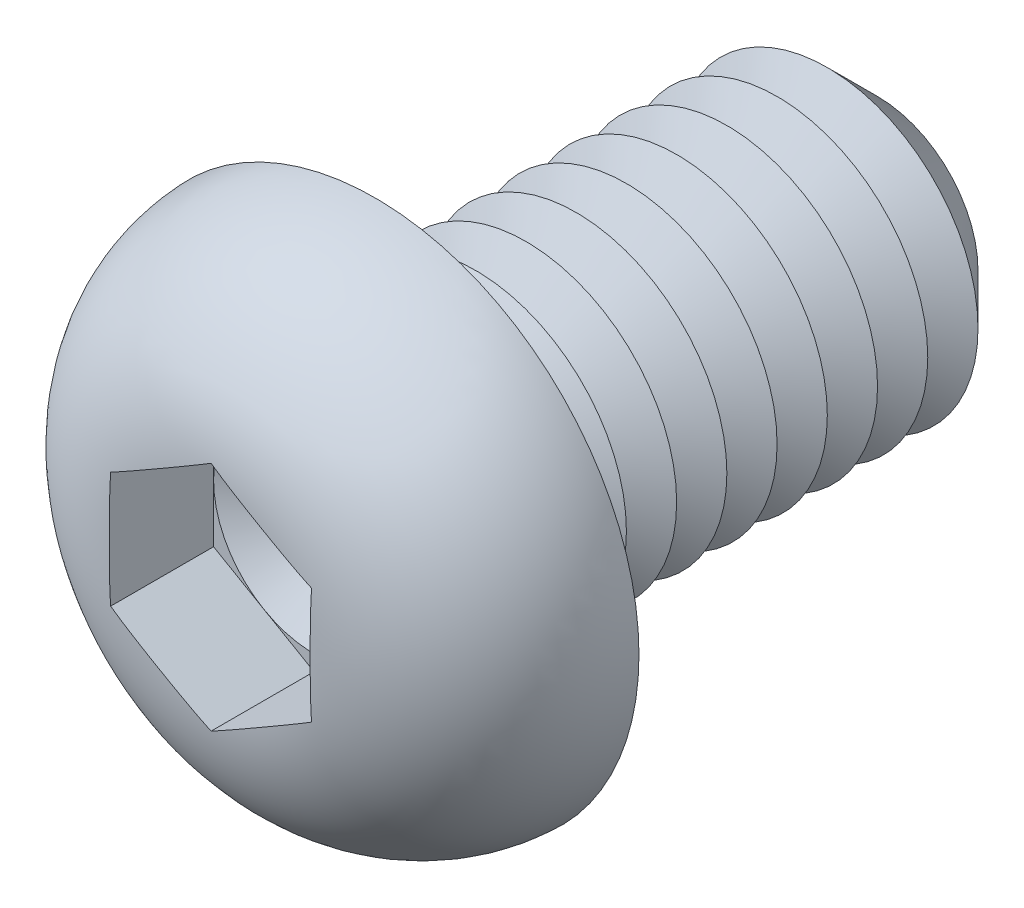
SolidWorks part; units mm, degrees
ref_plane "Front Plane" through (0, 0, 0) normal (0, 0, 1) x (1, 0, 0)
ref_plane "Top Plane" through (0, 0, 0) normal (0, 1, 0) x (1, 0, 0)
ref_plane "Right Plane" through (0, 0, 0) normal (1, 0, 0) x (0, 0, -1)
sketch "Sketch1" plane through (0, 0, 0) normal (1, 0, 0) x (0, 0, -1)
  line L0 (-47.9342, 0) -> (60.3146, 0) construction
sketch "Sketch2" plane through (0, 0, 0) normal (1, 0, 0) x (0, 0, -1)
  line L0 (0, 0) -> (-3.3, 0)
  line L1 (-47.9342, 0) -> (60.3146, 0) construction
  line L2 (-3.3, 0) -> (-3.3, 1.8515)
  line L3 (0, 5.25) -> (0, 0)
  arc A0 (-3.3, 1.8515) -> (0, 5.25) centre (0.1, 1.8515) cw
  dimension "D1" = 3.4
  dimension "D2" = 3.3
  dimension "D3" = 5.25
revolve "Revolve1" add sketch "Sketch2" angle 360 about L0
sketch "Sketch3" plane through (0, 0, 3.3) normal (0, 0, 1) x (1, 0, 0)
  line L1 (0, 2.3094) -> (-2, 1.1547)
  line L2 (-2, 1.1547) -> (-2, -1.1547)
  line L3 (-2, -1.1547) -> (0, -2.3094)
  line L4 (0, -2.3094) -> (2, -1.1547)
  line L5 (2, -1.1547) -> (2, 1.1547)
  line L6 (2, 1.1547) -> (0, 2.3094)
  circle A0 centre (0, 0) radius 2 construction
  dimension "D1" = 4
extrude "Cut-Extrude1" cut sketch "Sketch3" against normal blind 2.08
sketch "Sketch4" plane through (0, 0, 0) normal (0, 0, -1) x (-1, 0, 0)
  circle A0 centre (0, 0) radius 3
  dimension "D1" = 6
extrude "Boss-Extrude1" add sketch "Sketch4" along normal blind 10
chamfer "Chamfer1" distance 1 angle 45 1 edges at (-3, 0, -10)
sketch "Sketch5" plane through (0, 0, 0) normal (1, 0, 0) x (0, 0, -1)
  line L0 (1, 3) -> (2, 3)
  line L1 (9, 3) -> (0, 3) construction
  line L2 (2, 3) -> (1.5, 2.134)
  line L3 (1.5, 2.134) -> (1, 3)
  line L4 (0, -5.25) -> (0, 5.25) construction
  line L5 (9, 3) -> (0, 3) construction
  dimension "D1" = 1
  dimension "D2" = 1
revolve "Cut-Revolve1" cut sketch "Sketch5" angle 360 about L0
pattern_linear "LPattern1" count 8 spacing 1 along (0, 0, -1) of "Cut-Revolve1"
fillet "Fillet2" radius 0.5 1 edges at (-3, 0, 0)
sketch "Sketch6" plane through (0, 0, 1.22) normal (0, 0, 1) x (1, 0, 0)
  line L0 (0, -2.3094) -> (2, -1.1547) construction
  circle A0 centre (0, 0) radius 2
extrude "Cut-Extrude2" cut sketch "Sketch6" against normal through all draft 60
